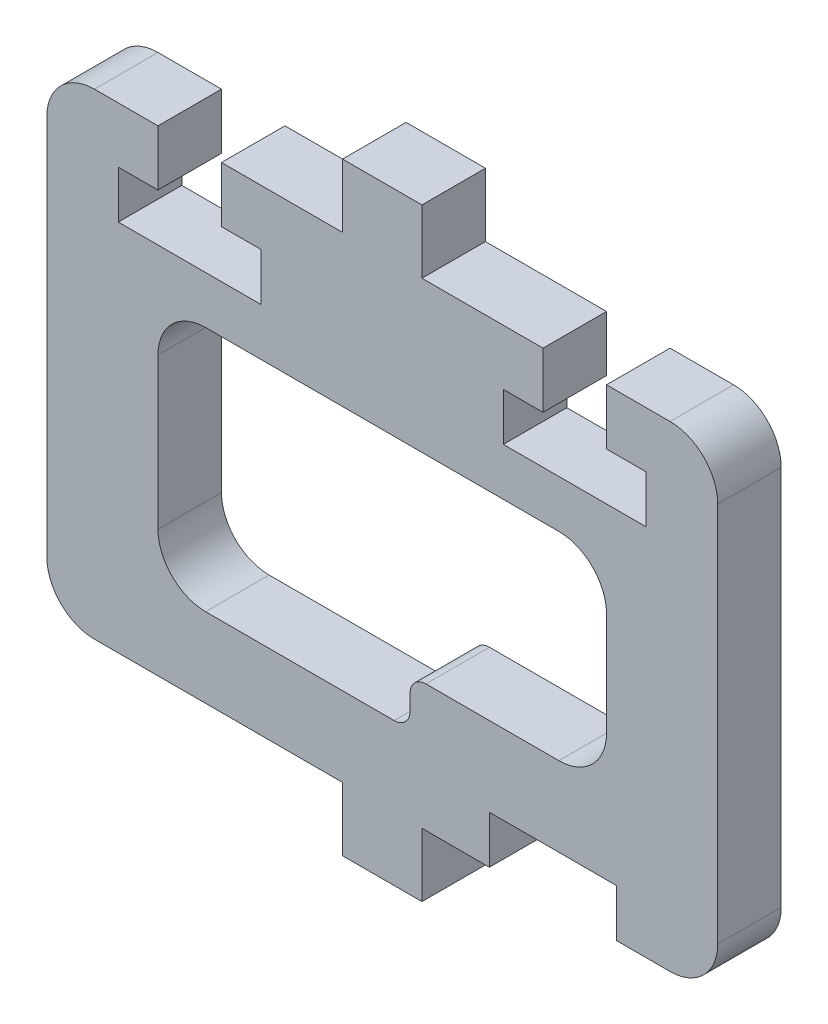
SolidWorks part; units mm, degrees
ref_plane "Alzado" through (0, 0, 0) normal (0, 0, 1) x (1, 0, 0)
ref_plane "Planta" through (0, 0, 0) normal (0, 1, 0) x (1, 0, 0)
ref_plane "Vista lateral" through (0, 0, 0) normal (1, 0, 0) x (0, 0, -1)
sketch "Croquis1" plane through (0, 0, 0) normal (0, 0, 1) x (1, 0, 0)
  line L0 (-102.6151, -94.222) -> (-98.3651, -94.222)
  line L1 (-98.3651, -94.222) -> (-98.3651, -91.222)
  line L2 (-107.6151, -60.222) -> (-105.1151, -60.222)
  line L3 (-102.6151, -64.222) -> (-94.9901, -64.222)
  line L4 (-107.6151, -94.222) -> (-123.2401, -94.222)
  line L5 (-105.1151, -60.222) -> (-102.6151, -60.222)
  line L6 (-102.6151, -60.222) -> (-102.6151, -64.222)
  line L7 (-94.9901, -64.222) -> (-94.9901, -67.722)
  line L8 (-94.9901, -67.722) -> (-97.4901, -67.722)
  line L9 (-97.4901, -67.722) -> (-97.4901, -70.722)
  line L10 (-97.4901, -70.722) -> (-88.4901, -70.722)
  line L11 (-88.4901, -70.722) -> (-88.4901, -67.722)
  line L12 (-88.4901, -67.722) -> (-90.9901, -67.722)
  line L13 (-90.9901, -67.722) -> (-90.9901, -64.222)
  line L14 (-119.2401, -64.222) -> (-123.2401, -64.222)
  line L15 (-83.9901, -91.222) -> (-83.9901, -67.222)
  line L16 (-90.9901, -64.222) -> (-86.9901, -64.222)
  line L17 (-119.2401, -67.722) -> (-119.2401, -64.222)
  line L18 (-121.7401, -67.722) -> (-119.2401, -67.722)
  line L19 (-121.7401, -70.722) -> (-121.7401, -67.722)
  line L20 (-121.7401, -70.722) -> (-112.7401, -70.722)
  line L21 (-112.7401, -67.722) -> (-112.7401, -70.722)
  line L22 (-115.2401, -67.722) -> (-112.7401, -67.722)
  line L23 (-115.2401, -64.222) -> (-115.2401, -67.722)
  line L24 (-107.6151, -60.222) -> (-107.6151, -64.222)
  line L25 (-107.6151, -64.222) -> (-115.2401, -64.222)
  line L26 (-107.6151, -98.222) -> (-107.6151, -94.222)
  line L27 (-102.6151, -98.222) -> (-102.6151, -94.222)
  line L28 (-105.1151, -98.222) -> (-102.6151, -98.222)
  line L29 (-107.6151, -98.222) -> (-105.1151, -98.222)
  line L30 (-98.3651, -91.222) -> (-90.3651, -91.222)
  line L31 (-90.3651, -91.222) -> (-90.3651, -94.222)
  line L32 (-126.2401, -91.222) -> (-126.2401, -67.222)
  line L33 (-86.9901, -94.222) -> (-90.3651, -94.222)
  arc A0 (-126.2401, -91.222) -> (-123.2401, -94.222) centre (-123.2401, -91.222) ccw
  arc A1 (-86.9901, -94.222) -> (-83.9901, -91.222) centre (-86.9901, -91.222) ccw
  arc A2 (-83.9901, -67.222) -> (-86.9901, -64.222) centre (-86.9901, -67.222) ccw
  arc A3 (-126.2401, -67.222) -> (-123.2401, -64.222) centre (-123.2401, -67.222) cw
  dimension "D1" = 3
extrude "Saliente-Extruir1" add sketch "Croquis1" along normal blind 4
sketch "Croquis2" plane through (0, 0, 4) normal (0, 0, 1) x (1, 0, 0)
  line L2 (-102.3651, -86.222) -> (-93.9901, -86.222)
  line L4 (-90.9901, -83.222) -> (-90.9901, -76.722)
  line L5 (-116.2401, -89.222) -> (-104.3651, -89.222)
  line L6 (-103.3651, -88.222) -> (-103.3651, -87.222)
  line L7 (-116.2401, -73.722) -> (-93.9901, -73.722)
  line L9 (-119.2401, -76.722) -> (-119.2401, -86.222)
  arc A0 (-119.2401, -86.222) -> (-116.2401, -89.222) centre (-116.2401, -86.222) ccw
  arc A1 (-93.9901, -86.222) -> (-90.9901, -83.222) centre (-93.9901, -83.222) ccw
  arc A2 (-90.9901, -76.722) -> (-93.9901, -73.722) centre (-93.9901, -76.722) ccw
  arc A3 (-116.2401, -73.722) -> (-119.2401, -76.722) centre (-116.2401, -76.722) ccw
  arc A4 (-104.3651, -89.222) -> (-103.3651, -88.222) centre (-104.3651, -88.222) ccw
  arc A5 (-103.3651, -87.222) -> (-102.3651, -86.222) centre (-102.3651, -87.222) cw
  dimension "D1" = 3
  dimension "D2" = 3
  dimension "D3" = 1
extrude "Cortar-Extruir1" cut sketch "Croquis2" against normal blind 4
